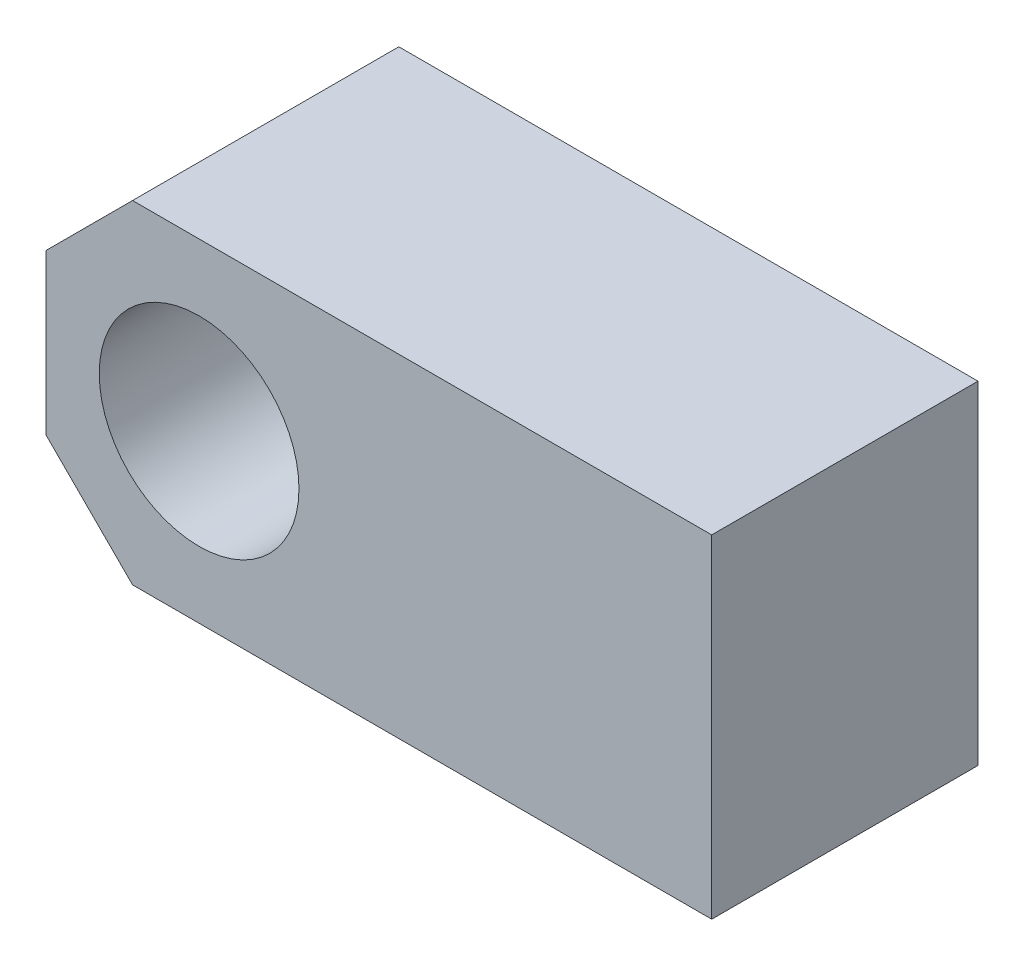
SolidWorks part; units mm, degrees
ref_plane "Plan de face" through (0, 0, 0) normal (0, 0, 1) x (1, 0, 0)
ref_plane "Plan de dessus" through (0, 0, 0) normal (0, 1, 0) x (1, 0, 0)
ref_plane "Plan de droite" through (0, 0, 0) normal (1, 0, 0) x (0, 0, -1)
sketch "Esquisse1" plane through (0, 0, 0) normal (0, 0, 1) x (1, 0, 0)
  line L0 (-100, 25) -> (-77, 25) construction
  line L1 (0, 0) -> (-100, 0)
  line L2 (0, 0) -> (0, 50)
  line L3 (0, 50) -> (-100, 50)
  line L4 (-100, 0) -> (-100, 50)
  circle A0 centre (-77, 25) radius 15
  dimension "D1" = 30
  dimension "D2" = 50
  dimension "D3" = 100
  dimension "D4" = 23
extrude "Boss.-Extru.1" add sketch "Esquisse1" along normal blind 40
chamfer "Chanfrein1" distance 13 angle 45 2 edges at (-100, 0, 20) (-100, 50, 20)
hole_wizard "Trou taraudé M81" positions "Esquisse3" profile "Esquisse2" tap size "M8" standard "ISO"
sketch "Esquisse3" plane through (0, 0, 0) normal (0, -1, 0) x (-1, 0, 0)
  line L0 (87, -40) -> (0, -40) construction
  line L1 (100, 0) -> (100, -40) construction
  point P0 (77, -20)
  dimension "D1" = 20
  dimension "D2" = 23
sketch "Esquisse2" plane through (-77, 0, 20) normal (1, 0, 0) x (0, 0, -1)
  line L0 (0, 0) -> (0, 24.2929)
  line L1 (0, 24.2929) -> (3.4, 22.25)
  line L2 (3.4, 22.25) -> (3.4, 0)
  line L5 (3.4, 0) -> (0, 0)
  line L10 (0, 24.2929) -> (-3.4, 22.25) construction
  line L11 (0, -6.35) -> (0, 107.95) construction
  dimension "Diamètre du trou pour taraudage" = 6.8
  dimension "Profondeur du trou pour taraudage" = 22.25
  dimension "Angle de pointe" = 118
